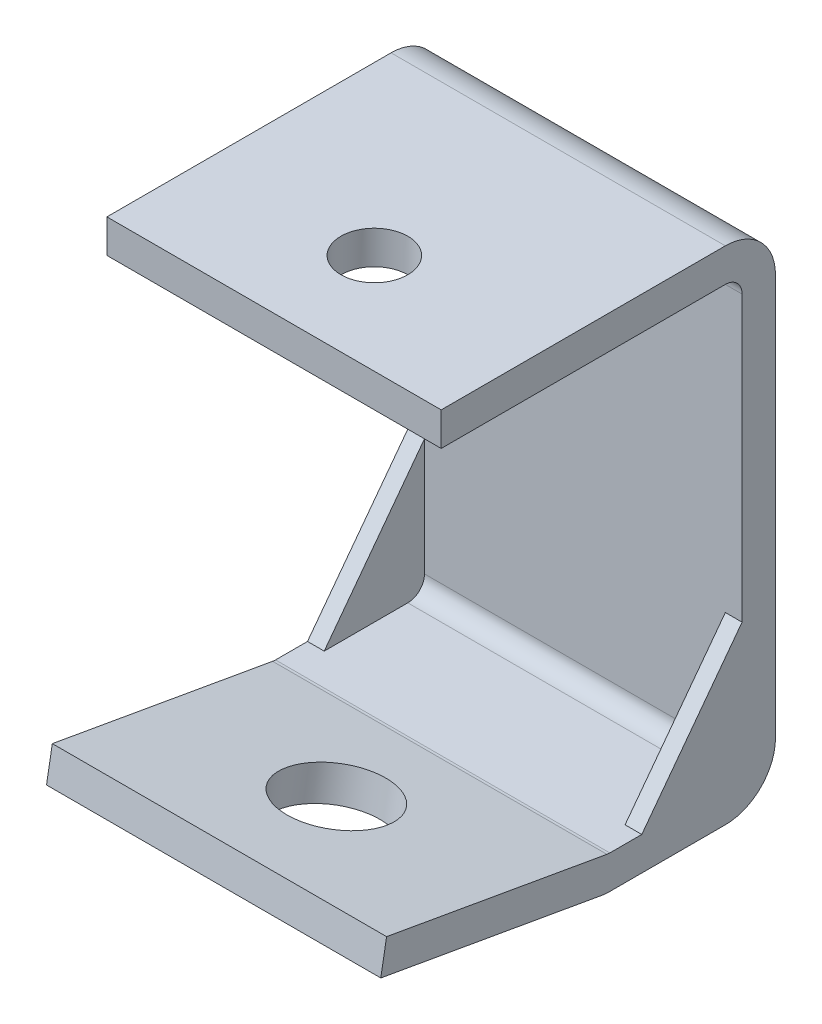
SolidWorks part; units mm, degrees
ref_plane "front" through (0, 0, 0) normal (0, 0, 1) x (1, 0, 0)
ref_plane "top" through (0, 0, 0) normal (0, 1, 0) x (1, 0, 0)
ref_plane "right" through (0, 0, 0) normal (1, 0, 0) x (0, 0, -1)
sketch "Sketch1" plane through (0, 0, 0) normal (1, 0, 0) x (0, 0, -1)
  line L0 (0, 0) -> (0, 82.55)
  line L1 (0, 82.55) -> (-57.15, 82.55)
  line L4 (-67.5238, 7.4276) -> (-25.4, 0)
  line L5 (-25.4, 0) -> (0, 0)
  dimension "D1" = 82.55
  dimension "D2" = 57.15
  dimension "D3" = 10
  dimension "D4" = 42.7736
  dimension "D5" = 25.4
extrude "Base-Extrude-Thin" add sketch "Sketch1" along normal mid plane 63.5 thin
sketch "Sketch2" plane through (0, 88.9, 0) normal (0, 1, 0) x (-1, 0, 0)
  line L0 (0, 50) -> (0, -50) construction
  line L1 (-31.75, 57.15) -> (31.75, 57.15) construction
  circle A0 centre (0, 38.1) radius 6.35
  dimension "D1" = 12.7
  dimension "D2" = 19.05
extrude "Cut-Extrude1" cut sketch "Sketch2" against normal up to next
sketch "Sketch3" plane through (31.75, 0, 0) normal (1, 0, 0) x (0, 0, -1)
  line L0 (-25.1222, 0) -> (-3.175, 0) construction
  line L1 (0, 3.175) -> (0, 79.375) construction
  line L2 (-19.05, 0) -> (-3.175, 0)
  line L3 (0, 3.175) -> (0, 25.4)
  line L4 (-19.05, 0) -> (0, 25.4)
  arc A0 (-3.175, 0) -> (0, 3.175) centre (-3.175, 3.175) ccw construction
  arc A1 (-3.175, 0) -> (0, 3.175) centre (-3.175, 3.175) ccw
  dimension "D1" = 25.4
  dimension "D2" = 19.05
extrude "Boss-Extrude1" add sketch "Sketch3" against normal blind 3.175
mirror "Mirror1" about plane through (0, 0, 0) normal (1, 0, 0) of "Boss-Extrude1"
sketch "Sketch4" plane through (0, -4.3437, 0.7659) normal (0, 0.9848, -0.1736) x (-1, 0, 0)
  circle A0 centre (0, 45.2398) radius 9.525 construction
  circle A1 centre (0, 45.2398) radius 9.525
extrude "Cut-Extrude2" cut sketch "Sketch4" against normal through all
